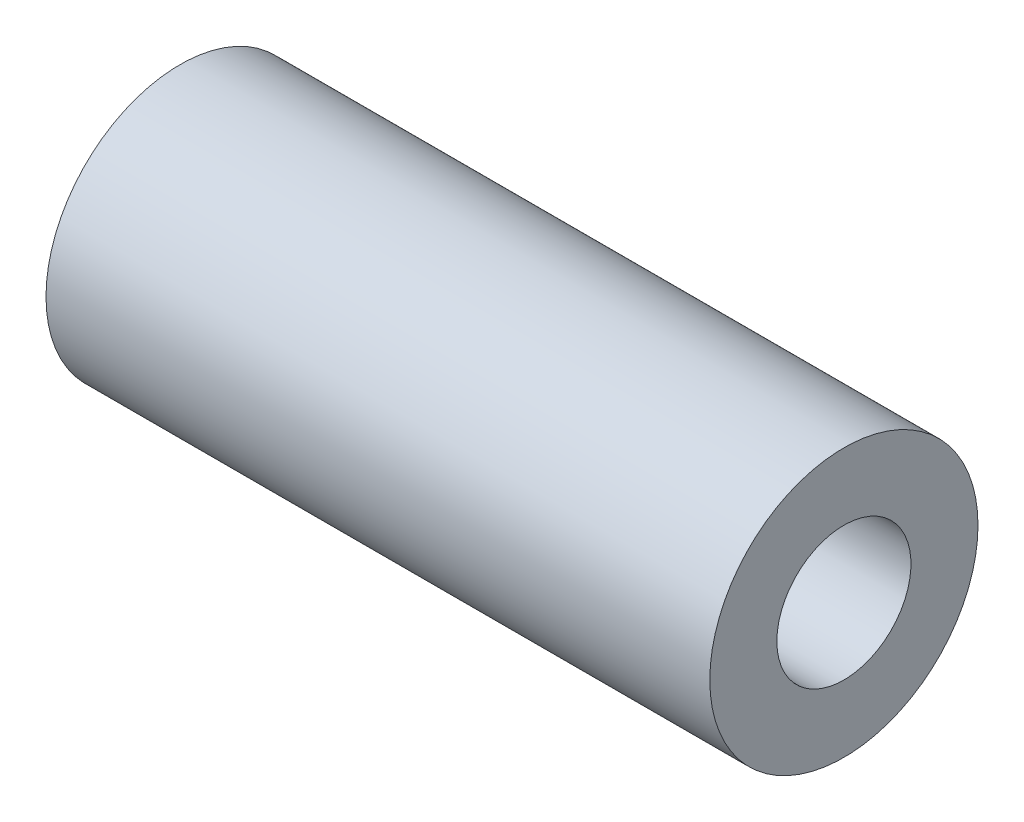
SolidWorks part; units mm, degrees
ref_plane "Piano frontale" through (0, 0, 0) normal (0, 0, 1) x (1, 0, 0)
ref_plane "Piano superiore" through (0, 0, 0) normal (0, 1, 0) x (1, 0, 0)
ref_plane "Piano destro" through (0, 0, 0) normal (1, 0, 0) x (0, 0, -1)
sketch "Schizzo1" plane through (0, 0, 0) normal (0, 0, 1) x (1, 0, 0)
  line L0 (-25.572, 0) -> (33.9161, 0) construction
  line L1 (-18.3802, 5) -> (-18.3802, 10)
  line L2 (-18.3802, 10) -> (31.1198, 10)
  line L3 (31.1198, 10) -> (31.1198, 5)
  line L4 (31.1198, 5) -> (-18.3802, 5)
  dimension "D1" = 10
  dimension "D2" = 49.5
  dimension "D3" = 5
revolve "Rivoluzione1" add sketch "Schizzo1" angle 360 about L0
